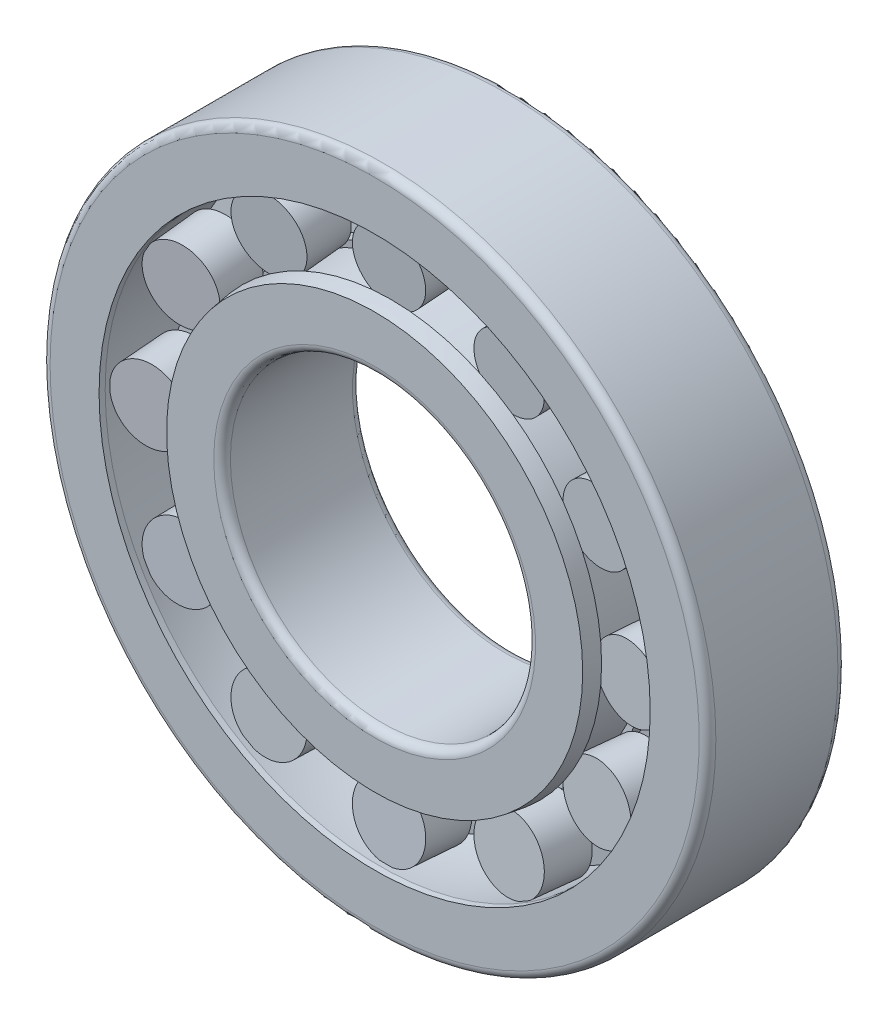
SolidWorks part; units mm, degrees
ref_plane "Front Plane" through (0, 0, 0) normal (0, 0, 1) x (1, 0, 0)
ref_plane "Top Plane" through (0, 0, 0) normal (0, 1, 0) x (1, 0, 0)
ref_plane "Right Plane" through (0, 0, 0) normal (1, 0, 0) x (0, 0, -1)
sketch "BaseSke" plane through (0, 0, 0) normal (1, 0, 0) x (0, 0, -1)
  line L0 (-47.2296, 0) -> (69.4868, 0) construction
  line L2 (0, 129.5214) -> (0, 100.8084) construction
  line L3 (-25, 55) -> (-25, 75) construction
  line L4 (-25, 120) -> (25, 120) construction
  line L5 (-25, 55) -> (25, 55) construction
  line L7 (25, 55) -> (25, 75) construction
  line L8 (25, 99) -> (25, 120) construction
  line L9 (-25, 99) -> (-25, 120) construction
  line L11 (0, 88.9532) -> (-25, 87) construction
  line L12 (0, 88.9532) -> (25, 87) construction
  line L13 (-25, 99) -> (-25, 75) construction
  line L14 (0, 77.098) -> (0, -86.3012) construction
  line L15 (0, 100.8084) -> (0, 77.098) construction
  line L16 (-19.8067, 86.5699) -> (-18.7801, 73.4297) construction
  line L17 (-20.8333, 99.7101) -> (-4.2173, 101.0082)
  line L18 (-20.8333, 99.7101) -> (-19.8067, 86.5699)
  line L19 (-18.7801, 73.4297) -> (-2.1641, 74.7278) construction
  line L20 (-4.2173, 101.0082) -> (-3.1907, 87.868)
  line L21 (-2.1641, 74.7278) -> (-3.1907, 87.868) construction
  line L22 (-19.8067, 86.5699) -> (-3.1907, 87.868)
  line L23 (-25, 86.1641) -> (0, 88.1173) construction
  arc A1 (-25, 99) -> (25, 99) centre (0, -72.902) cw construction
  arc A2 (25, 75) -> (-25, 75) centre (0, -72.902) ccw construction
  dimension "D2" = 20
  dimension "D1" = 150
  dimension "Bearing_Thickness" = 50
  dimension "Bearing_Outside_Diameter" = 240
  dimension "Bearing_Inside_Diameter" = 110
  dimension "D3" = 21
  dimension "D4" = 16.6667
  dimension "D5" = 4.1667
  dimension "D6" = 0.8333
revolve "Roller" add sketch "BaseSke" angle 360 about L23
sketch "OuterRaceSke" plane through (0, 0, 0) normal (1, 0, 0) x (0, 0, -1)
  line L0 (0, 0) -> (0, 94.5438) construction
  line L1 (-25, 120) -> (25, 120)
  line L2 (-25, 120) -> (-25, 98.9798)
  line L3 (25, 120) -> (25, 98.9798)
  line L5 (-50.3916, 0) -> (55.2197, 0) construction
  arc A0 (-25, 98.9798) -> (25, 98.9798) centre (0, -72.902) cw
  arc A2 (25, 99) -> (-25, 99) centre (0, -72.902) ccw construction
  dimension "D1" = 0.02
revolve "OuterRace" add sketch "OuterRaceSke" angle 360 about L5
sketch "InnerRaceSke" plane through (0, 0, 0) normal (1, 0, 0) x (0, 0, -1)
  line L0 (-70.8626, 0) -> (113.5527, 0) construction
  line L1 (0, 90.393) -> (0, -90.393) construction
  line L2 (-25, 55) -> (25, 55)
  line L3 (-25, 55) -> (-25, 75)
  line L4 (-19.0719, 75.8806) -> (-18.8814, 73.4418)
  line L5 (-18.8814, 73.4418) -> (-2.0659, 74.7556)
  line L7 (-2.0659, 74.7556) -> (-2.2476, 77.0812)
  line L8 (-19.8067, 86.5699) -> (-18.7801, 73.4297) construction
  line L9 (2.0659, 74.7556) -> (2.2476, 77.0812)
  line L10 (-2.1641, 74.7278) -> (-3.1907, 87.868) construction
  line L11 (-18.7801, 73.4297) -> (-2.1641, 74.7278) construction
  line L14 (18.8814, 73.4418) -> (2.0659, 74.7556)
  line L15 (19.0719, 75.8806) -> (18.8814, 73.4418)
  line L16 (25, 55) -> (25, 75)
  arc A0 (-25, 75) -> (-19.0719, 75.8806) centre (0, -72.902) cw
  arc A1 (25, 75) -> (-25, 75) centre (0, -72.902) ccw construction
  arc A2 (-2.2476, 77.0812) -> (2.2476, 77.0812) centre (0, -72.902) cw
  arc A3 (25, 75) -> (19.0719, 75.8806) centre (0, -72.902) ccw
  point P38 (0, 55)
  dimension "D2" = 0.1
  dimension "D1" = 0.02
  dimension "D3" = 0.1
revolve "InnerRace" add sketch "InnerRaceSke" angle 360 about L0
mirror "MirrorRoller" about plane through (0, 0, 0) normal (0, 0, 1) of "Roller"
fillet "Fillet1" radius 3 4 edges at (55, 0, 25) (120, 0, 25) (55, 0, -25) (120, 0, -25)
sketch "CutGrooveSke" plane through (0, 0, 0) normal (1, 0, 0) x (0, 0, -1)
  line L0 (-51.8407, 0) -> (83.8302, 0) construction
  line L1 (-12.5, -137.6) -> (-15, -137.6)
  line L2 (-12.5, -137.6) -> (-12.5, -117.6)
  line L3 (-12.5, -117.6) -> (-15, -117.6)
  line L4 (-15, -137.6) -> (-15, -117.6)
  dimension "D1" = 117.6
  dimension "D2" = 12.5
  dimension "D3" = 2.5
  dimension "D4" = 20
revolve "CutGroove" [suppressed] cut sketch "CutGrooveSke" angle 360 about L0
sketch "TaperSke" plane through (0, 0, 0) normal (1, 0, 0) x (0, 0, -1)
  line L0 (-25, 55) -> (25, 55)
  line L1 (25, 55) -> (25, 59.1667)
  line L2 (25, 59.1667) -> (-25, 55)
  line L7 (-41.2502, 0) -> (40.8606, 0) construction
  dimension "Taper" = 4.1667
revolve "Taper" [suppressed] cut sketch "TaperSke" angle 360 about L7
fillet "Fillet2" [suppressed] radius 3
pattern_circular "CirPatternBall" count 12 over 360 about axis through (0, 0, 0) along (0, 0, 1) of "Roller", "MirrorRoller"
sketch "SimplifiedSke" plane through (0, 0, 0) normal (1, 0, 0) x (0, 0, -1)
  line L0 (37.5911, 0) -> (-37.5911, 0) construction
  line L1 (0, 0) -> (0, 96.8272) construction
  line L2 (-18.7801, 73.4297) -> (-2.1641, 74.7278)
  line L3 (-18.7801, 73.4297) -> (-20.8333, 99.7101)
  line L4 (-20.8333, 99.7101) -> (-4.2173, 101.0082)
  line L5 (-2.1641, 74.7278) -> (-4.2173, 101.0082)
  line L7 (2.1641, 74.7278) -> (4.2173, 101.0082)
  line L8 (18.7801, 73.4297) -> (2.1641, 74.7278)
  line L9 (18.7801, 73.4297) -> (20.8333, 99.7101)
  line L10 (20.8333, 99.7101) -> (4.2173, 101.0082)
revolve "Simplified" [suppressed] add sketch "SimplifiedSke" angle 360 about L0
chamfer "Chamfer" distance 2.0833 angle 10 2 edges at (98.9798, 0, -25) (98.9798, 0, 25)
equation "\"D1@BaseSke\" = \"Bearing_Thickness@BaseSke\"*3"
equation "\"D2@BaseSke\" =  ( \"Bearing_Outside_Diameter@BaseSke\" - \"Bearing_Inside_Diameter@BaseSke\" ) /6.5"
equation "\"D3@BaseSke\" = \"D2@BaseSke\"*1.05"
equation "\"D4@BaseSke\" = \"Bearing_Thickness@BaseSke\"/3"
equation "\"D5@BaseSke\" = \"Bearing_Thickness@BaseSke\"/12"
equation "\"D6@BaseSke\" = \"Bearing_Thickness@BaseSke\"/60"
equation "\"D1@CutGrooveSke\" = \"Bearing_Outside_Diameter@BaseSke\" * 0.49"
equation "\"D2@CutGrooveSke\" = \"Bearing_Thickness@BaseSke\" *0.25"
equation "\"D3@CutGrooveSke\" = \"Bearing_Thickness@BaseSke\"/20"
equation "\"Taper@TaperSke\" = \"Bearing_Thickness@BaseSke\"/12"
equation "\"D1@Fillet2\" = \"Fillet_radius@Fillet1\""
equation "\"D1@CirPatternBall\" =  int(  ( \"Bearing_Outside_Diameter@BaseSke\" + \"Bearing_Inside_Diameter@BaseSke\" )  / 2 *  pi  /  ( \"Bearing_Outside_Diameter@BaseSke\" - \"Bearing_Inside_Diameter@BaseSke\" ) * 3 ) "
equation "\"D1@Chamfer\" = \"Bearing_Thickness@BaseSke\"/24"
